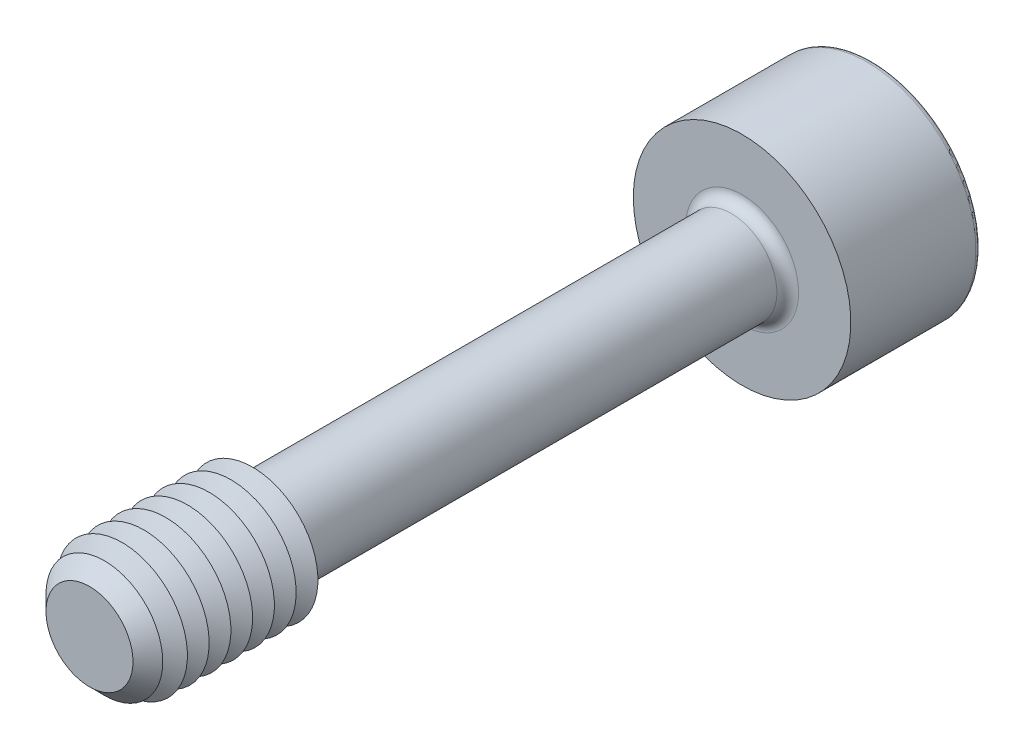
SolidWorks part; units mm, degrees
ref_plane "Front Plane" through (0, 0, 0) normal (0, 0, 1) x (1, 0, 0)
ref_plane "Top Plane" through (0, 0, 0) normal (0, 1, 0) x (1, 0, 0)
ref_plane "Right Plane" through (0, 0, 0) normal (1, 0, 0) x (0, 0, -1)
sketch "Sketch1" plane through (0, 0, 0) normal (0, 0, 1) x (1, 0, 0)
  circle A0 centre (0, 0) radius 2.1
  dimension "D1" = 4.2
extrude "Extrude1" add sketch "Sketch1" along normal mid plane 30
sketch "Sketch2" plane through (0, 0, 0) normal (1, 0, 0) x (0, 0, -1)
  line L0 (-15, 0) -> (-15, 3)
  line L1 (-15, 2.1) -> (-15, -2.1) construction
  line L2 (-15, 3) -> (-7.5, 3)
  line L3 (-7.5, 3) -> (-6.9804, 2.1)
  line L4 (15, 2.1) -> (-15, 2.1) construction
  line L5 (-6.9804, 2.1) -> (-6.9804, 0)
  line L6 (-6.9804, 0) -> (-15, 0)
  dimension "D1" = 3
  dimension "D2" = 120
  dimension "D3" = 7.5
revolve "Revolve1" add sketch "Sketch2" angle 360 about L6
chamfer "Chamfer1" distance 1 angle 45 1 edges at (0, 3, 15)
sketch "Sketch3" plane through (0, 0, -15) normal (0, 0, -1) x (-1, 0, 0)
  circle A0 centre (0, 0) radius 5
  dimension "D1" = 10
extrude "Extrude2" add sketch "Sketch3" along normal blind 6
sketch "Sketch4" plane through (-13.7, 0, -21) normal (0, 0, 1) x (1, 0, 0)
  line L2 (12.2566, -2.5) -> (15.1434, -2.5)
  line L3 (15.1434, -2.5) -> (16.5868, 0)
  line L4 (16.5868, 0) -> (15.1434, 2.5)
  line L6 (15.1434, 2.5) -> (12.2566, 2.5)
  line L7 (12.2566, 2.5) -> (10.8132, 0)
  line L8 (10.8132, 0) -> (12.2566, -2.5)
  circle A0 centre (13.7, 0) radius 2.5 construction
  dimension "D1" = 5
extrude "Extrude3" cut sketch "Sketch4" along normal blind 5
fillet "Fillet1" radius 0.5 1 edges at (-2.1, 0, -15)
fillet "Fillet2" radius 0.25 1 edges at (-5, 0, -21)
sketch "Sketch5" plane through (0, 0, 0) normal (1, 0, 0) x (0, 0, -1)
  line L0 (16, 0) -> (16, -2.5)
  line L1 (16, -2.5) -> (14.5566, 0)
  line L2 (14.5566, 0) -> (16, 0)
  dimension "D1" = 30
revolve "Cut-Revolve1" cut sketch "Sketch5" angle 360 about L2
sketch "Sketch6" plane through (0, 0, 0) normal (1, 0, 0) x (0, 0, -1)
  line L0 (1.332, 0) -> (-13.289, 0) construction
sketch "Sketch7" plane through (0, 0, 0) normal (1, 0, 0) x (0, 0, -1)
  line L0 (-7.5, 3) -> (-8, 2.134)
  line L1 (-8, 2.134) -> (-8.5, 3)
  line L2 (-7.5, 3) -> (-14, 3) construction
  line L3 (-8.5, 3) -> (-7.5, 3)
  dimension "D1" = 1
revolve "Cut-Revolve2" cut sketch "Sketch7" angle 360 about L0
pattern_linear "LPattern1" count 7 spacing 1 along (0, 0, 1) of "Cut-Revolve2"
